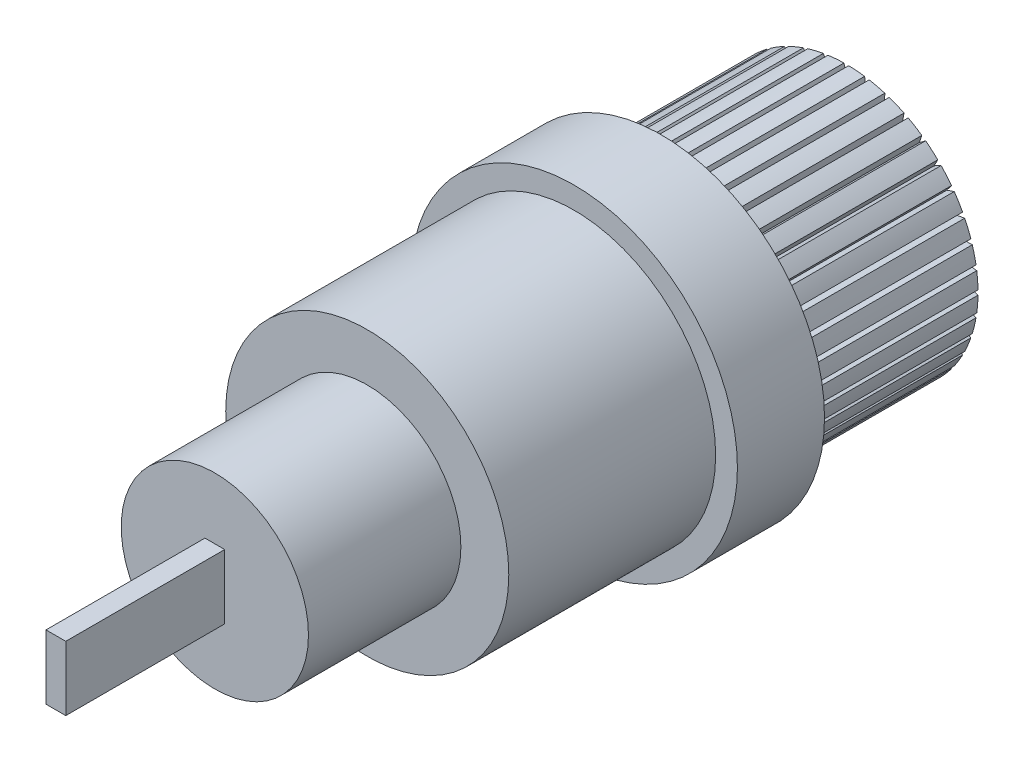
SolidWorks part; units mm, degrees
ref_plane "前视基准面" through (0, 0, 0) normal (0, 0, 1) x (1, 0, 0)
ref_plane "上视基准面" through (0, 0, 0) normal (0, 1, 0) x (1, 0, 0)
ref_plane "右视基准面" through (0, 0, 0) normal (1, 0, 0) x (0, 0, -1)
other "Configuration Table"
sketch "草图1" plane through (0, 0, 0) normal (0, 0, 1) x (1, 0, 0)
  circle A0 centre (0, 0) radius 6.05
  dimension "D1" = 12.1
extrude "凸台-拉伸1" add sketch "草图1" along normal blind 8.5
sketch "草图2" plane through (0, 0, 8.5) normal (0, 0, 1) x (1, 0, 0)
  circle A0 centre (0, 0) radius 7.5
  dimension "D1" = 15
extrude "凸台-拉伸2" add sketch "草图2" along normal blind 4
sketch "草图3" plane through (0, 0, 12.5) normal (0, 0, 1) x (1, 0, 0)
  circle A0 centre (0, 0) radius 6.5
  dimension "D1" = 13
extrude "凸台-拉伸3" add sketch "草图3" along normal blind 9.5
sketch "草图4" plane through (0, 0, 22) normal (0, 0, 1) x (1, 0, 0)
  circle A0 centre (0, 0) radius 4.3
  dimension "D1" = 8.6
extrude "凸台-拉伸4" add sketch "草图4" along normal blind 7
sketch "草图5" plane through (0, 0, 29) normal (0, 0, 1) x (1, 0, 0)
  line L1 (-0.454, 1.4785) -> (0.454, 1.4785)
  line L2 (-0.454, 1.4785) -> (-0.454, -1.4785)
  line L3 (-0.454, -1.4785) -> (0.454, -1.4785)
  line L4 (0.454, 1.4785) -> (0.454, -1.4785)
  line L5 (-0.454, 1.4785) -> (0.454, -1.4785) construction
  line L6 (-0.454, -1.4785) -> (0.454, 1.4785) construction
  point P0 (0, 0)
extrude "凸台-拉伸5" add sketch "草图5" along normal blind 7.3
sketch "草图6" plane through (0, 0, 0) normal (0, 0, -1) x (-1, 0, 0)
  line L0 (0, 0) -> (0, 7.5) construction
  line L1 (-0.3143, 6.7244) -> (0, 5.7)
  line L2 (0, 5.7) -> (0.3143, 6.7244)
  line L3 (0.3143, 6.7244) -> (-0.3143, 6.7244)
  circle A0 centre (0, 0) radius 7.5 construction
  dimension "D1" = 5.7
extrude "切除-拉伸2" cut sketch "草图6" against normal up to surface (8.5 mm away)
pattern_circular "阵列(圆周)1" count 40 over 360 about axis through (0, -0.0019, 0) along (0, 0, 1) of "切除-拉伸2"
